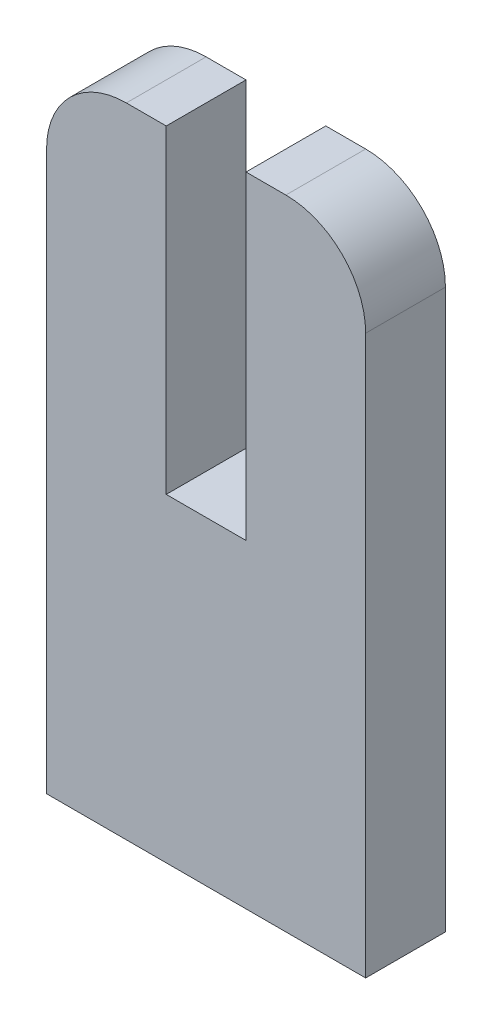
SolidWorks part; units mm, degrees
ref_plane "Front Plane" through (0, 0, 0) normal (0, 0, 1) x (1, 0, 0)
ref_plane "Top Plane" through (0, 0, 0) normal (0, 1, 0) x (1, 0, 0)
ref_plane "Right Plane" through (0, 0, 0) normal (1, 0, 0) x (0, 0, -1)
sketch "Sketch1" plane through (0, 0, 0) normal (0, 0, 1) x (1, 0, 0)
  line L1 (-6.35, 12.7) -> (6.35, 12.7)
  line L2 (-6.35, 12.7) -> (-6.35, -12.7)
  line L3 (-6.35, -12.7) -> (6.35, -12.7)
  line L4 (6.35, 12.7) -> (6.35, -12.7)
  line L5 (-6.35, 12.7) -> (6.35, -12.7) construction
  line L6 (-6.35, -12.7) -> (6.35, 12.7) construction
  point P0 (0, 0)
  dimension "D1" = 25.4
  dimension "D2" = 12.7
extrude "Boss-Extrude1" add sketch "Sketch1" along normal mid plane 3.175
sketch "Sketch2" plane through (0, 0, 1.5875) normal (0, 0, 1) x (1, 0, 0)
  line L0 (6.35, 12.7) -> (-6.35, 12.7) construction
  line L1 (-1.5875, 12.7) -> (1.5875, 12.7)
  line L2 (-1.5875, 12.7) -> (-1.5875, 0)
  line L3 (-1.5875, 0) -> (1.5875, 0)
  line L4 (1.5875, 12.7) -> (1.5875, 0)
  dimension "D1" = 12.7
  dimension "D2" = 3.175
  dimension "D3" = 1.5875
extrude "Cut-Extrude1" cut sketch "Sketch2" against normal through all
fillet "Fillet1" radius 3.175 2 edges at (6.35, 12.7, 0) (-6.35, 12.7, 0)
